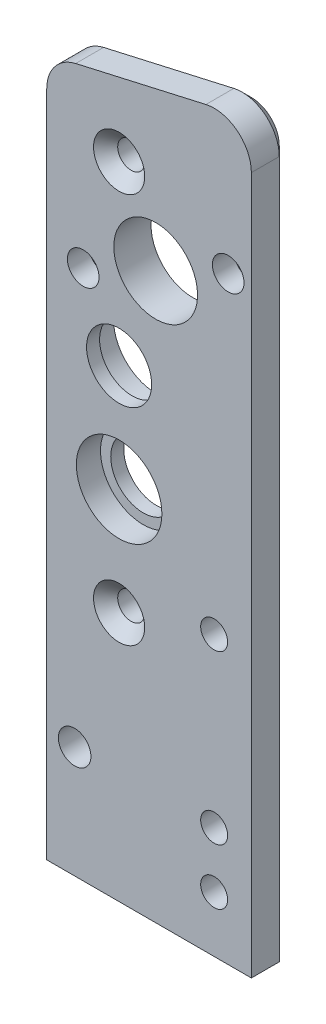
SolidWorks part; units mm, degrees
ref_plane "Plano frontal" through (0, 0, 0) normal (0, 0, 1) x (1, 0, 0)
ref_plane "Plano superior" through (0, 0, 0) normal (0, 1, 0) x (1, 0, 0)
ref_plane "Plano direito" through (0, 0, 0) normal (1, 0, 0) x (0, 0, -1)
sketch "Esboço1" plane through (0, 0, 0) normal (0, 0, 1) x (1, 0, 0)
  line L0 (0, 0) -> (22, 0)
  line L1 (22, 0) -> (22, 80)
  line L2 (22, 80) -> (0, 75)
  line L3 (0, 75) -> (0, 0)
  dimension "D1" = 22
  dimension "D2" = 80
  dimension "D3" = 75
extrude "Ressalto-extrusão1" add sketch "Esboço1" along normal blind 4
fillet "Filete1" radius 4 2 edges at (22, 80, 2) (0, 75, 2)
chamfer "Chanfro1" distance 1 angle 45 5 edges at (0, 35.9035, 0) (0.8738, 74.3025, 0) (10.1135, 77.2985, 0) (20.4954, 78.1151, 0) (22, 37.4945, 0)
sketch "Esboço2" plane through (0, 0, 4) normal (0, 0, 1) x (1, 0, 0)
  line L0 (0, 71.8071) -> (0, 0) construction
  point P0 (14.1, 34.4)
  dimension "D1" = 34.4
  dimension "D2" = 14.1
sketch "Esboço4" plane through (0, 0, 0) normal (0, 0, -1) x (-1, 0, 0)
  line L0 (0, 0) -> (-7.7809, 0) construction
  line L1 (-1, 0) -> (-21, 0) construction
  line L2 (-7.7809, 0) -> (-7.7809, 38.3937) construction
  line L3 (0, 0) -> (10, 0) construction
  line L4 (10, 0) -> (10, 13) construction
  line L5 (10, 13) -> (-21, 13) construction
  line L6 (10, 13) -> (-7.7809, 38.3937) construction
  circle A0 centre (10, 13) radius 31 construction
  dimension "D3" = 62
  dimension "D1" = 10
  dimension "D2" = 13
  dimension "D4" = 55
hole_wizard "Furo de diâmetro Ø7.0 (7)1" positions "3DSketch1" profile "Esboço5" hole size "Ø7.0" standard "ISO"
sketch3d "3DSketch1"
  point P0 (7.7809, 38.3937, 0)
sketch "Esboço5" plane through (7.7809, 38.3937, 0) normal (1, 0, 0) x (0, 1, 0)
  line L0 (0, 0) -> (0, 4)
  line L1 (0, 4) -> (3.5, 4)
  line L2 (3.5, 4) -> (3.5, 0)
  line L5 (3.5, 0) -> (0, 0)
  line L11 (0, -6.35) -> (0, 107.95) construction
  dimension "Thru Hole Dia." = 7
  dimension "Thru Hole Depth" = 4
sketch "Esboço7" plane through (0, 0, 0) normal (0, 0, -1) x (-1, 0, 0)
  line L0 (-18, 6) -> (-18, 12) construction
  line L1 (-1, 0) -> (-21, 0) construction
  line L2 (-18, 12) -> (-3, 12) construction
  line L3 (0, 71.8071) -> (0, 0) construction
  point P0 (-18, 6)
  dimension "D1" = 18
  dimension "D2" = 6
  dimension "D3" = 6
  dimension "D4" = 3
hole_wizard "Escareado para parafuso com cabeça escareada elevada de M2.51" positions "3DSketch3" profile "Esboço8" countersink size "M2.5" standard "ISO"
sketch3d "3DSketch3"
  point P0 (18, 6, 0)
  point P3 (18, 12, 0)
sketch "Esboço8" plane through (18, 6, 0) normal (1, 0, 0) x (0, 1, 0)
  line L0 (0, 0) -> (0, 4)
  line L1 (0, 4) -> (1.45, 4)
  line L2 (1.45, 4) -> (1.45, 1.3)
  line L3 (1.45, 1.3) -> (2.75, 0)
  line L5 (2.75, 0) -> (0, 0)
  line L6 (-1.45, 1.3) -> (-2.75, 0) construction
  line L11 (0, -6.35) -> (0, 107.95) construction
  dimension "Thru Hole Dia." = 2.9
  dimension "Thru Hole Depth" = 4
  dimension "Near C'Sink Dia." = 5.5
  dimension "Near C'Sink Angle" = 90
sketch "Esboço9" plane through (0, 0, 0) normal (0, -1, 0) x (1, 0, 0)
  line L0 (0, 4) -> (0, 0) construction
  line L1 (0, 2) -> (22, 2) construction
  line L2 (22, 4) -> (22, 1) construction
  point P8 (4, 2)
  point P9 (8, 2)
  point P10 (12, 2)
  dimension "D1" = 4
  dimension "D2" = 4
  dimension "D3" = 4
hole_wizard "Broca de rosquear para tarraxa de M21" positions "3DSketch4" profile "Esboço11" hole size "M2" standard "ISO"
sketch3d "3DSketch4"
  point P0 (4, 0, 2)
  point P6 (12, 0, 2)
sketch "Esboço11" plane through (4, 0, 2) normal (1, 0, 0) x (0, 0, -1)
  line L0 (0, 0) -> (0, 8.4807)
  line L1 (0, 8.4807) -> (0.8, 8)
  line L2 (0.8, 8) -> (0.8, 0)
  line L5 (0.8, 0) -> (0, 0)
  line L10 (0, 8.4807) -> (-0.8, 8) construction
  line L11 (0, -6.35) -> (0, 107.95) construction
  dimension "Hole Dia." = 1.6
  dimension "Hole Depth" = 8
  dimension "Drill Angle" = 118
sketch "Esboço12" plane through (0, 0, 4) normal (0, 0, 1) x (1, 0, 0)
  circle A0 centre (7.7809, 38.3937) radius 3.5 construction
  circle A1 centre (7.7809, 38.3937) radius 4.6
  point P0 (7.7809, 38.3937)
  dimension "D1" = 9.2
sketch "Esboço15" plane through (0, 0, 0) normal (0, 0, -1) x (-1, 0, 0)
  line L0 (-7.7809, 38.3937) -> (-7.7809, 49.8937) construction
  line L1 (-7.7809, 49.8937) -> (-11.7141, 60.7002) construction
  line L4 (-19.5083, 64.3347) -> (-3.9199, 57.0657) construction
  line L6 (0, 71.8071) -> (0, 0) construction
  circle A0 centre (-7.7809, 49.8937) radius 11.5 construction
  circle A1 centre (-11.7141, 60.7002) radius 8.6 construction
  circle A2 centre (-7.7809, 49.8937) radius 4.6
  point P4 (-7.7809, 49.8937)
  point P7 (-11.7141, 60.7002)
  dimension "D2" = 17.2
  dimension "D6" = 9.2
  dimension "D1" = 11.5
  dimension "D3" = 135
  dimension "D4" = 200
  dimension "D5" = 0
hole_wizard "Furo de diâmetro Ø9.0 (9)3" positions "3DSketch9" profile "Esboço22" hole size "Ø9.0" standard "ISO"
sketch3d "3DSketch9"
  point P4 (11.7141, 60.7002, 0)
sketch "Esboço22" plane through (11.7141, 60.7002, 0) normal (1, 0, 0) x (0, 1, 0)
  line L0 (0, 0) -> (0, 4)
  line L1 (0, 4) -> (4.5, 4)
  line L2 (4.5, 4) -> (4.5, 0)
  line L5 (4.5, 0) -> (0, 0)
  line L11 (0, -6.35) -> (0, 107.95) construction
  dimension "Thru Hole Dia." = 9
  dimension "Thru Hole Depth" = 4
sketch "Esboço24" plane through (0, 0, 4) normal (0, 0, 1) x (1, 0, 0)
  point P0 (7.7809, 49.8937)
hole_wizard "Escareado para parafuso Allen sextavado escareado de M31" positions "3DSketch14" profile "Esboço28" countersink size "M3" standard "ISO"
sketch3d "3DSketch14"
  point P0 (19.5083, 64.3347, 0)
  point P3 (3.9199, 57.0657, 0)
sketch "Esboço28" plane through (19.5083, 64.3347, 0) normal (1, 0, 0) x (0, 1, 0)
  line L0 (0, 0) -> (0, 4)
  line L1 (0, 4) -> (1.7, 4)
  line L2 (1.7, 4) -> (1.7, 1.66)
  line L3 (1.7, 1.66) -> (3.36, 0)
  line L5 (3.36, 0) -> (0, 0)
  line L6 (-1.7, 1.66) -> (-3.36, 0) construction
  line L11 (0, -6.35) -> (0, 107.95) construction
  dimension "Thru Hole Dia." = 3.4
  dimension "Thru Hole Depth" = 4
  dimension "Near C'Sink Dia." = 6.72
  dimension "Near C'Sink Angle" = 90
sketch "Esboço30" plane through (0, 0, 0) normal (0, 0, -1) x (-1, 0, 0)
  line L0 (-22, 0) -> (-22, 74.9889) construction
  line L1 (0, 0) -> (-22, 0) construction
  point P0 (-18, 30)
  dimension "D1" = 4
  dimension "D2" = 30
hole_wizard "Escareado para parafuso com cabeça escareada chata de M2.51" positions "3DSketch16" profile "Esboço31" countersink size "M2.5" standard "ISO"
sketch3d "3DSketch16"
  point P0 (18, 30, 0)
sketch "Esboço31" plane through (18, 30, 0) normal (1, 0, 0) x (0, 1, 0)
  line L0 (0, 0) -> (0, 4.8712)
  line L1 (0, 4.8712) -> (1.45, 4)
  line L2 (1.45, 4) -> (1.45, 1.3)
  line L3 (1.45, 1.3) -> (2.75, 0)
  line L5 (2.75, 0) -> (0, 0)
  line L6 (-1.45, 1.3) -> (-2.75, 0) construction
  line L10 (0, 4.8712) -> (-1.45, 4) construction
  line L11 (0, -6.35) -> (0, 107.95) construction
  dimension "Hole Dia." = 2.9
  dimension "Hole Depth" = 4
  dimension "Near C'Sink Dia." = 5.5
  dimension "Near C'Sink Angle" = 90
  dimension "Drill Angle" = 118
extrude "Corte-extrusão1" cut sketch "Esboço12" against normal blind 2.6
extrude "Corte-extrusão2" cut sketch "Esboço15" against normal blind 2.6
sketch "Esboço32" plane through (0, 0, 4) normal (0, 0, 1) x (1, 0, 0)
  line L0 (7.7809, 68.8937) -> (7.7809, 49.8937) construction
  line L1 (0, 71.8071) -> (0, 0) construction
  line L2 (7.7809, 68.8937) -> (7.7809, 26.8937) construction
  dimension "D1" = 19
  dimension "D2" = 42
hole_wizard "Escareado para parafuso com cabeça escareada chata de M2.52" positions "3DSketch17" profile "Esboço33" countersink size "M2.5" standard "ISO"
sketch3d "3DSketch17"
  point P0 (7.7809, 68.8937, 4)
  point P3 (7.7809, 26.8937, 4)
sketch "Esboço33" plane through (7.7809, 68.8937, 4) normal (1, 0, 0) x (0, -1, 0)
  line L0 (0, 0) -> (0, 4)
  line L1 (0, 4) -> (1.45, 4)
  line L2 (1.45, 4) -> (1.45, 1.3)
  line L3 (1.45, 1.3) -> (2.75, 0)
  line L5 (2.75, 0) -> (0, 0)
  line L6 (-1.45, 1.3) -> (-2.75, 0) construction
  line L11 (0, -6.35) -> (0, 107.95) construction
  dimension "Thru Hole Dia." = 2.9
  dimension "Thru Hole Depth" = 4
  dimension "Near C'Sink Dia." = 5.5
  dimension "Near C'Sink Angle" = 90
hole_wizard "Furo de diâmetro Ø7.0 (7)2" positions "3DSketch18" profile "Esboço34" hole size "Ø7.0" standard "ISO"
sketch3d "3DSketch18"
  point P0 (7.7809, 49.8937, 0)
sketch "Esboço34" plane through (7.7809, 49.8937, 0) normal (1, 0, 0) x (0, 1, 0)
  line L0 (0, 0) -> (0, 4)
  line L1 (0, 4) -> (3.5, 4)
  line L2 (3.5, 4) -> (3.5, 0)
  line L5 (3.5, 0) -> (0, 0)
  line L11 (0, -6.35) -> (0, 107.95) construction
  dimension "Thru Hole Dia." = 7
  dimension "Thru Hole Depth" = 4
hole_wizard "Furo de diâmetro Ø3.5 (3.5)1" positions "3DSketch19" profile "Esboço35" hole size "Ø3.5" standard "ISO"
sketch3d "3DSketch19"
  point P0 (3, 12, 0)
sketch "Esboço35" plane through (3, 12, 0) normal (1, 0, 0) x (0, 1, 0)
  line L0 (0, 0) -> (0, 4)
  line L1 (0, 4) -> (1.75, 4)
  line L2 (1.75, 4) -> (1.75, 0)
  line L5 (1.75, 0) -> (0, 0)
  line L11 (0, -6.35) -> (0, 107.95) construction
  dimension "Thru Hole Dia." = 3.5
  dimension "Thru Hole Depth" = 4
